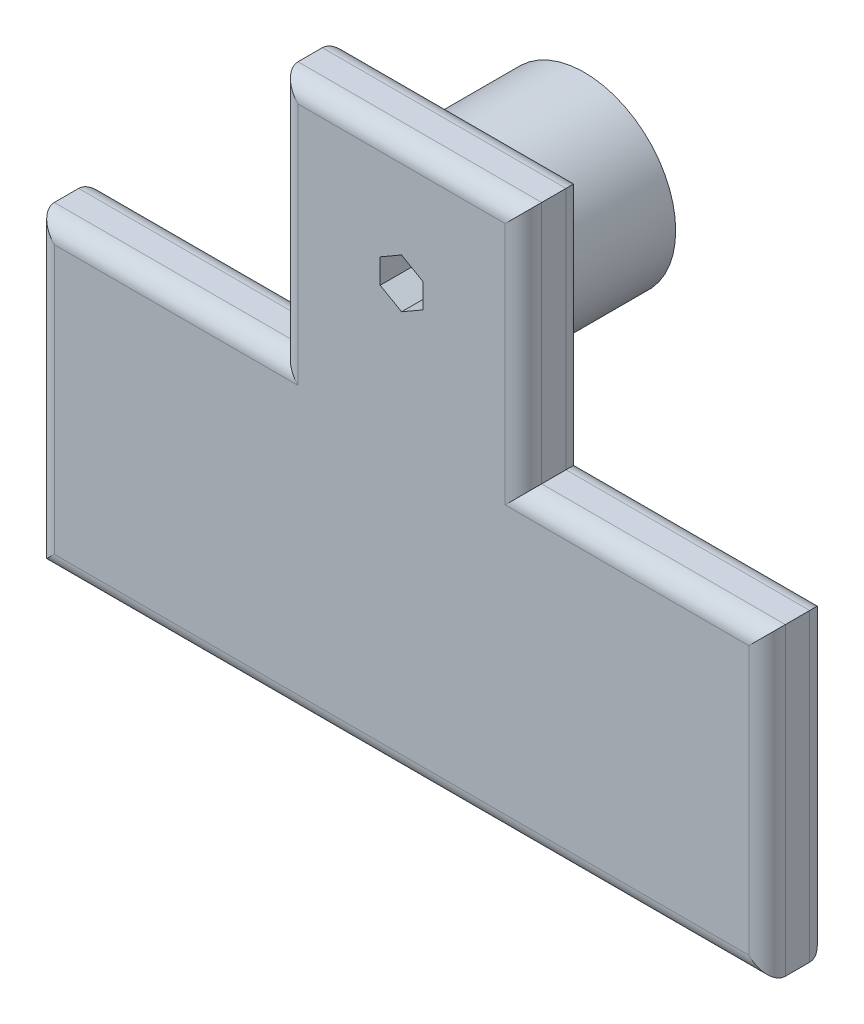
SolidWorks part; units mm, degrees
ref_plane "Plan de face" through (0, 0, 0) normal (0, 0, 1) x (1, 0, 0)
ref_plane "Plan de dessus" through (0, 0, 0) normal (0, 1, 0) x (1, 0, 0)
ref_plane "Plan de droite" through (0, 0, 0) normal (1, 0, 0) x (0, 0, -1)
sketch "Esquisse1" plane through (0, 0, 0) normal (0, 0, 1) x (1, 0, 0)
  line L0 (0, 0) -> (0, 50000) construction
  line L1 (-20, 20) -> (20, 20)
  line L2 (-60, -20) -> (-60, -70)
  line L3 (-60, -70) -> (60, -70)
  line L4 (60, -20) -> (60, -70)
  line L5 (0, 0) -> (-50000, 0) construction
  line L6 (60, -20) -> (20, -20)
  line L7 (0, -4.0415) -> (3.5, -2.0207)
  line L8 (3.5, -2.0207) -> (3.5, 2.0207)
  line L9 (3.5, 2.0207) -> (0, 4.0415)
  line L10 (0, 4.0415) -> (-3.5, 2.0207)
  line L11 (-3.5, 2.0207) -> (-3.5, -2.0207)
  line L12 (-3.5, -2.0207) -> (0, -4.0415)
  line L15 (-60, -20) -> (-20, -20)
  line L16 (-20, 20) -> (-20, -20)
  line L17 (20, 20) -> (20, -20)
  circle A0 centre (0, 0) radius 3.5 construction
extrude "Boss.-Extru.1" add sketch "Esquisse1" along normal blind 10
fillet "Congé1" radius 3 16 edges at (60, -45, 0) (0, 20, 0) (0, -70, 0) (-60, -45, 0) (0, 20, 10) (-20, 0, 10) (20, 0, 10) (0, -70, 10) (-60, -45, 10) (60, -45, 10) (40, -20, 10) (-20, 0, 0) (-40, -20, 0) (40, -20, 0) (20, 0, 0) (-40, -20, 10)
sketch "Esquisse2" plane through (0, 0, 0) normal (0, 0, 1) x (1, 0, 0)
  circle A0 centre (0, 0) radius 15
extrude "Boss.-Extru.2" add sketch "Esquisse2" against normal blind 20
sketch "Esquisse3" plane through (0, 0, 0) normal (0, 0, -1) x (-1, 0, 0)
  line L1 (-3.5, 2.0207) -> (-3.5, -2.0207)
  line L2 (-3.5, -2.0207) -> (0, -4.0415)
  line L3 (0, -4.0415) -> (3.5, -2.0207)
  line L4 (3.5, -2.0207) -> (3.5, 2.0207)
  line L5 (3.5, 2.0207) -> (0, 4.0415)
  line L6 (0, 4.0415) -> (-3.5, 2.0207)
  circle A0 centre (0, 0) radius 3.5 construction
extrude "Enlèv. mat.-Extru.1" cut sketch "Esquisse3" along normal blind 20
